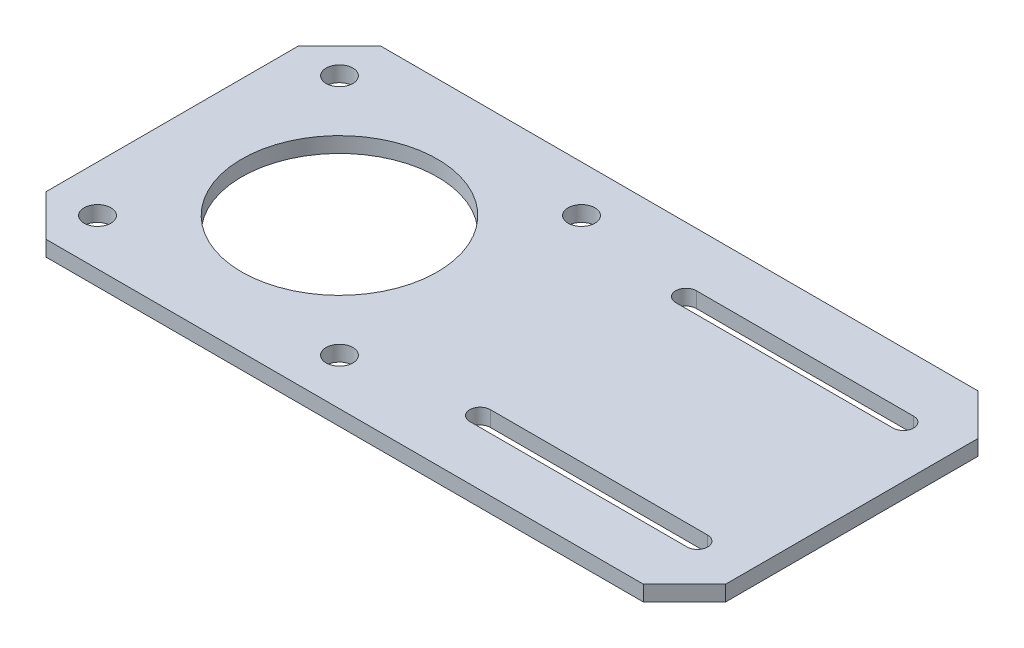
SolidWorks part; units mm, degrees
ref_plane "Front Plane" through (0, 0, 0) normal (0, 0, 1) x (1, 0, 0)
ref_plane "Top Plane" through (0, 0, 0) normal (0, 1, 0) x (1, 0, 0)
ref_plane "Right Plane" through (0, 0, 0) normal (1, 0, 0) x (0, 0, -1)
sketch "Sketch1" plane through (0, 0, 0) normal (0, 1, 0) x (1, 0, 0)
  line L1 (0, 0) -> (132, 0)
  line L2 (0, 0) -> (0, -65)
  line L3 (0, -65) -> (132, -65)
  line L4 (132, 0) -> (132, -65)
  dimension "D1" = 132
  dimension "D2" = 65
extrude "Main Plate Body" add sketch "Sketch1" along normal blind 3
chamfer "Chamfer1" distance 8 angle 45 4 edges at (0, 1.5, 65) (0, 1.5, 0) (132, 1.5, 0) (132, 1.5, 65)
sketch "Main Motor Hole" plane through (0, 3, 0) normal (0, 1, 0) x (1, 0, 0)
  line L1 (0, -8) -> (0, -57) construction
  line L3 (32.5, -13.5) -> (32.5, 0) construction
  line L5 (124, 0) -> (8, 0) construction
  line L7 (0, -32.5) -> (13.5, -32.5) construction
  line L9 (32.5, -51.5) -> (32.5, -65) construction
  line L10 (8, -65) -> (124, -65) construction
  circle A0 centre (32.5, -32.5) radius 19
  circle A1 centre (9, -56) radius 2.6
  circle A2 centre (56, -56) radius 2.6
  circle A3 centre (56, -9) radius 2.6
  circle A4 centre (9, -9) radius 2.6
  dimension "D1" = 38
  dimension "D2" = 5.2
  dimension "D3" = 23.5
  dimension "D4" = 23.5
extrude "Motor Holes" cut sketch "Main Motor Hole" against normal through all
sketch "T-Slot Mounting Slots" plane through (0, 3, 0) normal (0, 1, 0) x (1, 0, 0)
  line L0 (124, 0) -> (124, -65) construction
  line L1 (122, -50.5) -> (79.8, -50.5)
  line L2 (122, -10.5) -> (79.8, -10.5)
  line L4 (122, -14.5) -> (79.8, -14.5)
  line L6 (122, -54.5) -> (79.8, -54.5)
  line L7 (107.3161, 0) -> (107.3161, -10.5) construction
  line L8 (124, 0) -> (8, 0) construction
  line L9 (79.8, -12.5) -> (122, -12.5) construction
  line L10 (79.8, -52.5) -> (122, -52.5) construction
  line L12 (107.3161, -54.5) -> (107.3161, -65) construction
  line L13 (8, -65) -> (124, -65) construction
  arc A0 (79.8, -10.5) -> (79.8, -14.5) centre (79.8, -12.5) ccw
  arc A1 (122, -14.5) -> (122, -10.5) centre (122, -12.5) ccw
  arc A2 (79.8, -50.5) -> (79.8, -54.5) centre (79.8, -52.5) ccw
  arc A3 (122, -54.5) -> (122, -50.5) centre (122, -52.5) ccw
  dimension "D1" = 42.2
  dimension "D2" = 4
  dimension "D3" = 40
extrude "Mounting Slots" cut sketch "T-Slot Mounting Slots" against normal through all
